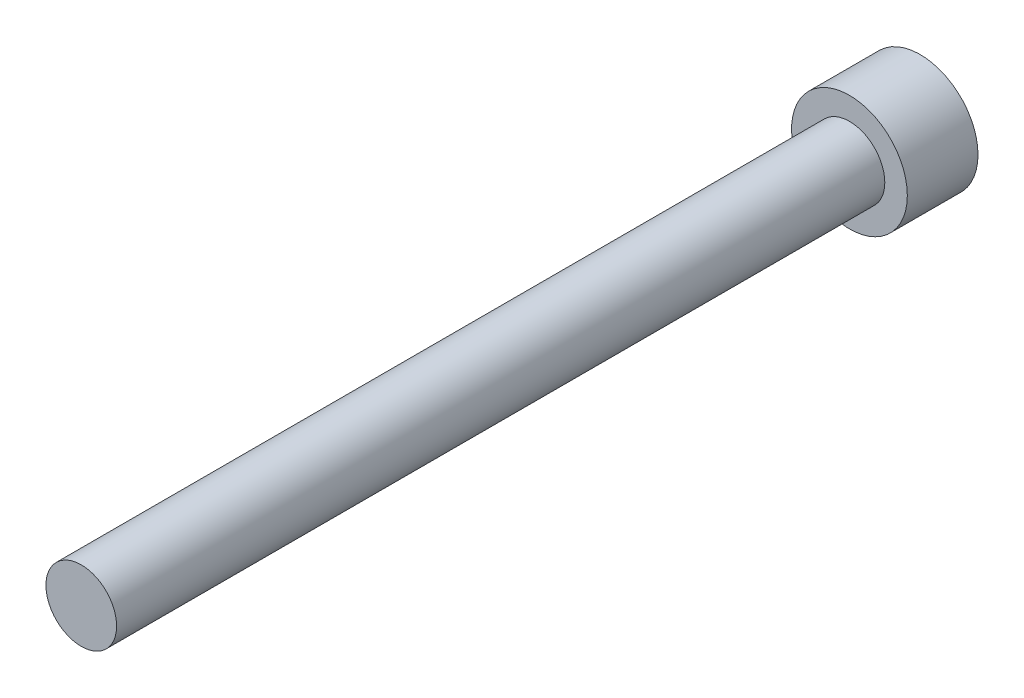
SolidWorks part; units mm, degrees
ref_plane "Front Plane" through (0, 0, 0) normal (0, 0, 1) x (1, 0, 0)
ref_plane "Top Plane" through (0, 0, 0) normal (0, 1, 0) x (1, 0, 0)
ref_plane "Right Plane" through (0, 0, 0) normal (1, 0, 0) x (0, 0, -1)
sketch "Sketch6" plane through (0, 0, 0) normal (1, 0, 0) x (0, 0, -1)
  line L0 (-38.1, 0) -> (22.525, 0) construction
  line L1 (3.1572, 0) -> (-3.1572, 0) construction
  line L2 (-38.1, 0) -> (-38.1, -1.7526)
  line L3 (-38.1, -1.7526) -> (0, -1.7526)
  line L4 (0, 3.1572) -> (0, -3.1572) construction
  line L5 (0, -1.7526) -> (0, -2.8702)
  line L6 (0, -2.8702) -> (3.5052, -2.8702)
  line L7 (3.5052, -2.8702) -> (3.5052, 0)
  line L8 (3.5052, 0) -> (-38.1, 0)
  dimension "L" = 38.1
  dimension "H" = 3.5052
  dimension "A" = 5.7404
  dimension "D" = 3.5052
revolve "Revolve1" add sketch "Sketch6" angle 360 about L0
sketch "Sketch7" plane through (0, 0, -3.5052) normal (0, 0, -1) x (-1, 0, 0)
  line L2 (-1.3843, 0.7992) -> (-1.3843, -0.7992)
  line L4 (-1.3843, -0.7992) -> (0, -1.5985)
  line L5 (0, -1.5985) -> (1.3843, -0.7992)
  line L6 (1.3843, -0.7992) -> (1.3843, 0.7992)
  line L7 (1.3843, 0.7992) -> (0, 1.5985)
  line L8 (0, 1.5985) -> (-1.3843, 0.7992)
  circle A0 centre (0, 0) radius 1.3843 construction
  dimension "J" = 2.7686
extrude "HEX" cut sketch "Sketch7" against normal blind 2.032
